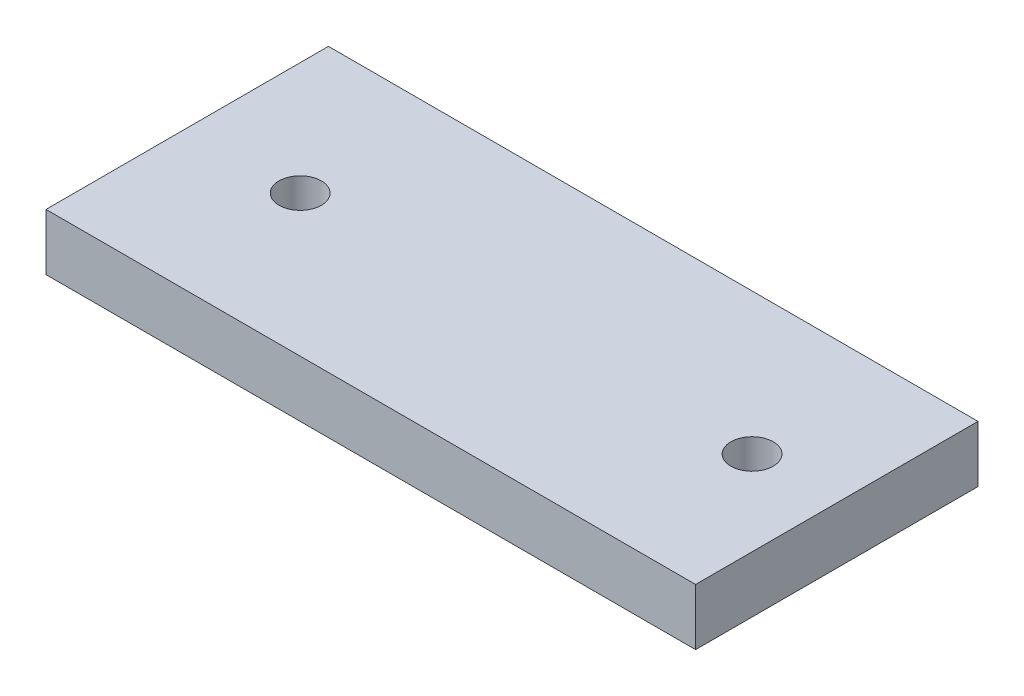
SolidWorks part; units mm, degrees
ref_plane "Front" through (0, 0, 0) normal (0, 0, 1) x (1, 0, 0)
ref_plane "Top" through (0, 0, 0) normal (0, 1, 0) x (1, 0, 0)
ref_plane "Right" through (0, 0, 0) normal (1, 0, 0) x (0, 0, -1)
sketch "Sketch1" plane through (0, 0, 0) normal (0, 1, 0) x (1, 0, 0)
  line L1 (69.85, 31.75) -> (-76.2, 31.75)
  line L2 (69.85, 31.75) -> (69.85, -31.75)
  line L3 (69.85, -31.75) -> (-76.2, -31.75)
  line L4 (-76.2, 31.75) -> (-76.2, -31.75)
  circle A0 centre (50.8, 0) radius 4.7625
  circle A1 centre (-50.8, 0) radius 4.7625
  point P0 (69.85, 31.75)
extrude "Extrude1" add sketch "Sketch1" along normal blind 12.7
